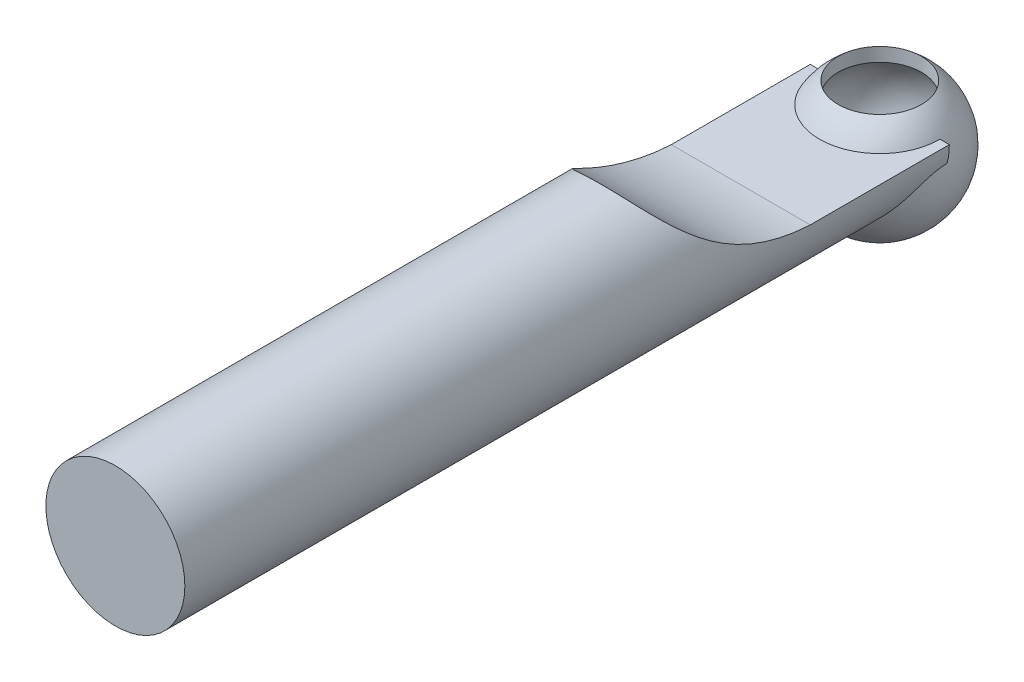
SolidWorks part; units mm, degrees
ref_plane "Front Plane" through (0, 0, 0) normal (0, 0, 1) x (1, 0, 0)
ref_plane "Top Plane" through (0, 0, 0) normal (0, 1, 0) x (1, 0, 0)
ref_plane "Right Plane" through (0, 0, 0) normal (1, 0, 0) x (0, 0, -1)
sketch "Sketch2" plane through (0, 0, 0) normal (0, 0, 1) x (1, 0, 0)
  circle A0 centre (0, 0) radius 10
  dimension "D1" = 20
extrude "Boss-Extrude1" add sketch "Sketch2" along normal mid plane 100
sketch "Sketch3" plane through (0, 0, 0) normal (1, 0, 0) x (0, 0, -1)
  line L0 (50, 0) -> (40, 0)
  line L1 (50, -10) -> (50, 10) construction
  line L2 (50, 10) -> (-50, 10) construction
  line L3 (20, 10) -> (50, 10)
  line L4 (50, 10) -> (50, 0)
  arc A0 (40, 0) -> (20, 10) centre (41.4277, 27.8553) cw
  dimension "D1" = 10
  dimension "D2" = 20
extrude "Cut-Extrude1" cut sketch "Sketch3" against normal mid plane 100
ref_plane "Plane1" through (0, -5, 0) normal (0, 1, 0) x (1, 0, 0)
sketch "Sketch4" plane through (0, -5, 0) normal (0, 1, 0) x (1, 0, 0)
  line L0 (0, 50) -> (0, 52) construction
  line L1 (-10, 50) -> (10, 50) construction
  line L2 (0, 70) -> (0, 68)
  line L3 (0, 68) -> (0, 70) construction
  line L4 (0, 52) -> (0, 50)
  line L5 (0, 50) -> (0, 81.6702) construction
  arc A0 (0, 50) -> (0, 70) centre (0, 60) ccw
  arc A1 (0, 52) -> (0, 68) centre (0, 60) ccw
  dimension "D2" = 16
  dimension "D1" = 20
revolve "Revolve1" add sketch "Sketch4" angle 360 about L5
sketch "Sketch5" plane through (0, -5, 0) normal (0, 1, 0) x (1, 0, 0)
  circle A0 centre (0, 60) radius 6
  dimension "D1" = 12
extrude "Cut-Extrude2" cut sketch "Sketch5" against normal mid plane 100
sketch "Sketch6" plane through (0, 0, -50) normal (0, 0, -1) x (-1, 0, 0)
  line L1 (10, 0) -> (-10, 0)
  line L2 (10, 0) -> (-10, 0)
  arc A1 (-10, 0) -> (10, 0) centre (0, 0) ccw
  arc A2 (-10, 0) -> (10, 0) centre (0, 0) ccw
  dimension "D1" = 0
extrude "Boss-Extrude2" add sketch "Sketch6" along normal blind 10
sketch "Sketch7" plane through (0, -5, 0) normal (0, 1, 0) x (1, 0, 0)
  line L0 (-6.245, 60) -> (6.245, 60) construction
  line L1 (0, 74.8947) -> (0, 43.8777) construction
  line L2 (0, 68.5) -> (0, 51.5)
  arc A0 (0, 51.5) -> (0, 68.5) centre (0, 60) ccw
  dimension "D1" = 17
revolve "Cut-Revolve1" cut sketch "Sketch7" angle 360 about L1
